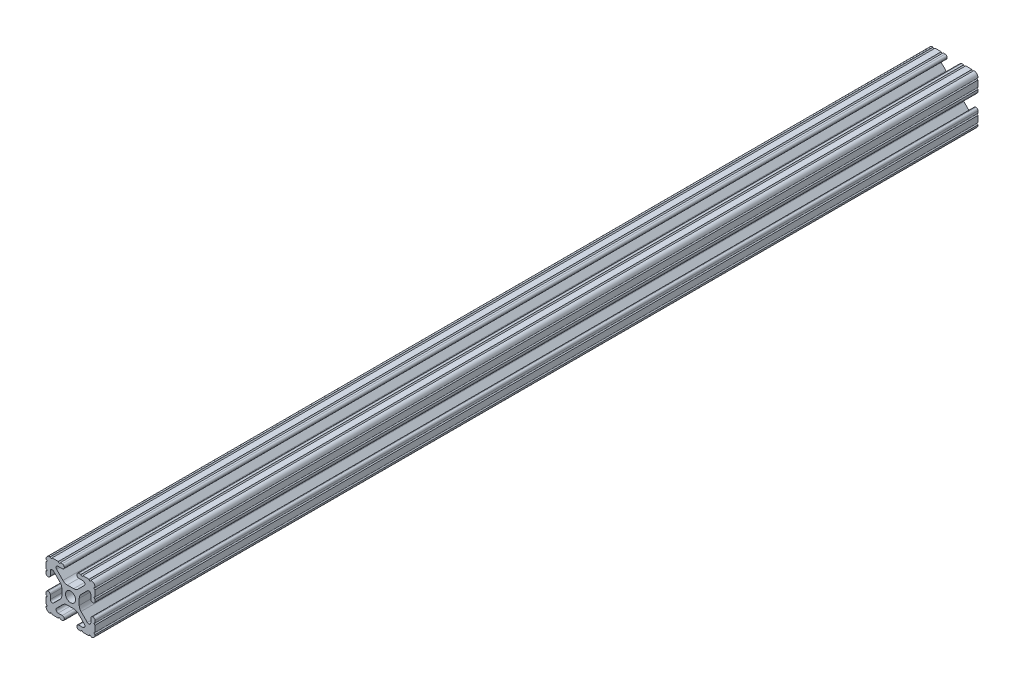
SolidWorks part; units mm, degrees
ref_plane "Front Plane" through (0, 0, 0) normal (0, 0, 1) x (1, 0, 0)
ref_plane "Top Plane" through (0, 0, 0) normal (0, 1, 0) x (1, 0, 0)
ref_plane "Right Plane" through (0, 0, 0) normal (1, 0, 0) x (0, 0, -1)
sketch "Sketch1" plane through (0, 0, 0) normal (0, 0, 1) x (1, 0, 0)
  line L88 (-7.1797, -8.6452) -> (-3.9523, -5.4237)
  line L89 (-1.7093, -4.4958) -> (1.7093, -4.4958)
  line L90 (3.9523, -5.4237) -> (7.1797, -8.6452)
  line L91 (6.4164, -10.4902) -> (4.2875, -10.4902)
  line L92 (3.2385, -11.5392) -> (3.2385, -11.651)
  line L93 (4.2875, -12.7) -> (5.3171, -12.7)
  line L94 (6.3331, -12.7) -> (9.5504, -12.7)
  line L95 (12.7, -9.5504) -> (12.7, -6.3331)
  line L96 (12.7, -5.3171) -> (12.7, -4.2875)
  line L97 (11.651, -3.2385) -> (11.5392, -3.2385)
  line L98 (10.4902, -4.2875) -> (10.4902, -6.4021)
  line L99 (8.7371, -7.1294) -> (5.441, -3.8408)
  line L100 (4.5085, -1.5932) -> (4.5085, 1.5932)
  line L101 (5.441, 3.8408) -> (8.7371, 7.1294)
  line L102 (10.4902, 6.4021) -> (10.4902, 4.2875)
  line L103 (11.5392, 3.2385) -> (11.651, 3.2385)
  line L104 (12.7, 4.2875) -> (12.7, 5.3171)
  line L105 (12.7, 6.3331) -> (12.7, 9.5504)
  line L106 (9.5504, 12.7) -> (6.3331, 12.7)
  line L107 (5.3171, 12.7) -> (4.2875, 12.7)
  line L108 (3.2385, 11.651) -> (3.2385, 11.5392)
  line L109 (4.2875, 10.4902) -> (6.4768, 10.4902)
  line L110 (7.207, 8.7244) -> (3.8983, 5.4232)
  line L111 (1.6558, 4.4958) -> (-1.6558, 4.4958)
  line L112 (-3.8983, 5.4232) -> (-7.207, 8.7244)
  line L113 (-6.4768, 10.4902) -> (-4.2875, 10.4902)
  line L114 (-3.2385, 11.5392) -> (-3.2385, 11.651)
  line L115 (-4.2875, 12.7) -> (-5.3171, 12.7)
  line L116 (-6.3331, 12.7) -> (-9.5504, 12.7)
  line L117 (-12.7, 9.5504) -> (-12.7, 6.3331)
  line L118 (-12.7, 5.3171) -> (-12.7, 4.2875)
  line L119 (-11.651, 3.2385) -> (-11.5392, 3.2385)
  line L120 (-10.4902, 4.2875) -> (-10.4902, 6.4021)
  line L121 (-8.7371, 7.1294) -> (-5.441, 3.8408)
  line L122 (-4.5085, 1.5932) -> (-4.5085, -1.5932)
  line L123 (-5.441, -3.8408) -> (-8.7371, -7.1294)
  line L124 (-10.4902, -6.4021) -> (-10.4902, -4.2875)
  line L125 (-11.5392, -3.2385) -> (-11.651, -3.2385)
  line L126 (-12.7, -4.2875) -> (-12.7, -5.3171)
  line L127 (-12.7, -6.3331) -> (-12.7, -9.5504)
  line L128 (-9.5504, -12.7) -> (-6.3331, -12.7)
  line L129 (-5.3171, -12.7) -> (-4.2875, -12.7)
  line L130 (-3.2385, -11.651) -> (-3.2385, -11.5392)
  line L131 (-4.2875, -10.4902) -> (-6.4164, -10.4902)
  circle A1 centre (0, 0) radius 2.6035
  arc A104 (-7.1797, -8.6452) -> (-6.4164, -10.4902) centre (-6.4164, -9.4098) ccw
  arc A105 (-1.7093, -4.4958) -> (-3.9523, -5.4237) centre (-1.7093, -7.6708) ccw
  arc A106 (3.9523, -5.4237) -> (1.7093, -4.4958) centre (1.7093, -7.6708) ccw
  arc A107 (6.4164, -10.4902) -> (7.1797, -8.6452) centre (6.4164, -9.4098) ccw
  arc A108 (4.2875, -10.4902) -> (3.2385, -11.5392) centre (4.2875, -11.5392) ccw
  arc A109 (3.2385, -11.651) -> (4.2875, -12.7) centre (4.2875, -11.651) ccw
  arc A110 (6.3331, -12.7) -> (5.3171, -12.7) centre (5.8251, -12.7) ccw
  arc A111 (10.5664, -12.6998) -> (9.5504, -12.7) centre (10.0584, -12.7) ccw
  arc A112 (10.5664, -12.6998) -> (12.6998, -10.5664) centre (10.5918, -10.5918) ccw
  arc A113 (12.7, -9.5504) -> (12.6998, -10.5664) centre (12.7, -10.0584) ccw
  arc A114 (12.7, -5.3171) -> (12.7, -6.3331) centre (12.7, -5.8251) ccw
  arc A115 (12.7, -4.2875) -> (11.651, -3.2385) centre (11.651, -4.2875) ccw
  arc A116 (11.5392, -3.2385) -> (10.4902, -4.2875) centre (11.5392, -4.2875) ccw
  arc A117 (8.7371, -7.1294) -> (10.4902, -6.4021) centre (9.4628, -6.4021) ccw
  arc A118 (4.5085, -1.5932) -> (5.441, -3.8408) centre (7.6835, -1.5932) ccw
  arc A119 (5.441, 3.8408) -> (4.5085, 1.5932) centre (7.6835, 1.5932) ccw
  arc A120 (10.4902, 6.4021) -> (8.7371, 7.1294) centre (9.4628, 6.4021) ccw
  arc A121 (10.4902, 4.2875) -> (11.5392, 3.2385) centre (11.5392, 4.2875) ccw
  arc A122 (11.651, 3.2385) -> (12.7, 4.2875) centre (11.651, 4.2875) ccw
  arc A123 (12.7, 6.3331) -> (12.7, 5.3171) centre (12.7, 5.8251) ccw
  arc A124 (12.6998, 10.5664) -> (12.7, 9.5504) centre (12.7, 10.0584) ccw
  arc A125 (12.6998, 10.5664) -> (10.5664, 12.6998) centre (10.5918, 10.5918) ccw
  arc A126 (9.5504, 12.7) -> (10.5664, 12.6998) centre (10.0584, 12.7) ccw
  arc A127 (5.3171, 12.7) -> (6.3331, 12.7) centre (5.8251, 12.7) ccw
  arc A128 (4.2875, 12.7) -> (3.2385, 11.651) centre (4.2875, 11.651) ccw
  arc A129 (3.2385, 11.5392) -> (4.2875, 10.4902) centre (4.2875, 11.5392) ccw
  arc A130 (7.207, 8.7244) -> (6.4768, 10.4902) centre (6.4768, 9.4563) ccw
  arc A131 (1.6558, 4.4958) -> (3.8983, 5.4232) centre (1.6558, 7.6708) ccw
  arc A132 (-3.8983, 5.4232) -> (-1.6558, 4.4958) centre (-1.6558, 7.6708) ccw
  arc A133 (-6.4768, 10.4902) -> (-7.207, 8.7244) centre (-6.4768, 9.4563) ccw
  arc A134 (-4.2875, 10.4902) -> (-3.2385, 11.5392) centre (-4.2875, 11.5392) ccw
  arc A135 (-3.2385, 11.651) -> (-4.2875, 12.7) centre (-4.2875, 11.651) ccw
  arc A136 (-6.3331, 12.7) -> (-5.3171, 12.7) centre (-5.8251, 12.7) ccw
  arc A137 (-10.5664, 12.6998) -> (-9.5504, 12.7) centre (-10.0584, 12.7) ccw
  arc A138 (-10.5664, 12.6998) -> (-12.6998, 10.5664) centre (-10.5918, 10.5918) ccw
  arc A139 (-12.7, 9.5504) -> (-12.6998, 10.5664) centre (-12.7, 10.0584) ccw
  arc A140 (-12.7, 5.3171) -> (-12.7, 6.3331) centre (-12.7, 5.8251) ccw
  arc A141 (-12.7, 4.2875) -> (-11.651, 3.2385) centre (-11.651, 4.2875) ccw
  arc A142 (-11.5392, 3.2385) -> (-10.4902, 4.2875) centre (-11.5392, 4.2875) ccw
  arc A143 (-8.7371, 7.1294) -> (-10.4902, 6.4021) centre (-9.4628, 6.4021) ccw
  arc A144 (-4.5085, 1.5932) -> (-5.441, 3.8408) centre (-7.6835, 1.5932) ccw
  arc A145 (-5.441, -3.8408) -> (-4.5085, -1.5932) centre (-7.6835, -1.5932) ccw
  arc A146 (-10.4902, -6.4021) -> (-8.7371, -7.1294) centre (-9.4628, -6.4021) ccw
  arc A147 (-10.4902, -4.2875) -> (-11.5392, -3.2385) centre (-11.5392, -4.2875) ccw
  arc A148 (-11.651, -3.2385) -> (-12.7, -4.2875) centre (-11.651, -4.2875) ccw
  arc A149 (-12.7, -6.3331) -> (-12.7, -5.3171) centre (-12.7, -5.8251) ccw
  arc A150 (-12.6998, -10.5664) -> (-12.7, -9.5504) centre (-12.7, -10.0584) ccw
  arc A151 (-12.6998, -10.5664) -> (-10.5664, -12.6998) centre (-10.5918, -10.5918) ccw
  arc A152 (-9.5504, -12.7) -> (-10.5664, -12.6998) centre (-10.0584, -12.7) ccw
  arc A153 (-5.3171, -12.7) -> (-6.3331, -12.7) centre (-5.8251, -12.7) ccw
  arc A154 (-4.2875, -12.7) -> (-3.2385, -11.651) centre (-4.2875, -11.651) ccw
  arc A155 (-3.2385, -11.5392) -> (-4.2875, -10.4902) centre (-4.2875, -11.5392) ccw
extrude "Boss-Extrude1" add sketch "Sketch1" along normal mid plane 609.6
sketch "Sketch2" plane through (0, 0, 0) normal (1, 0, 0) x (0, 0, -1)
  line L1 (304.8, 18.5996) -> (152.4, 18.5996)
  line L2 (304.8, 18.5996) -> (304.8, -27.9452)
  line L3 (304.8, -27.9452) -> (152.4, -27.9452)
  line L4 (152.4, 18.5996) -> (152.4, -27.9452)
  line L5 (304.8, 6.3331) -> (304.8, 9.5504) construction
  dimension "D1" = 152.4
extrude "Cut-Extrude1" cut sketch "Sketch2" against normal through all both and the other way through all
